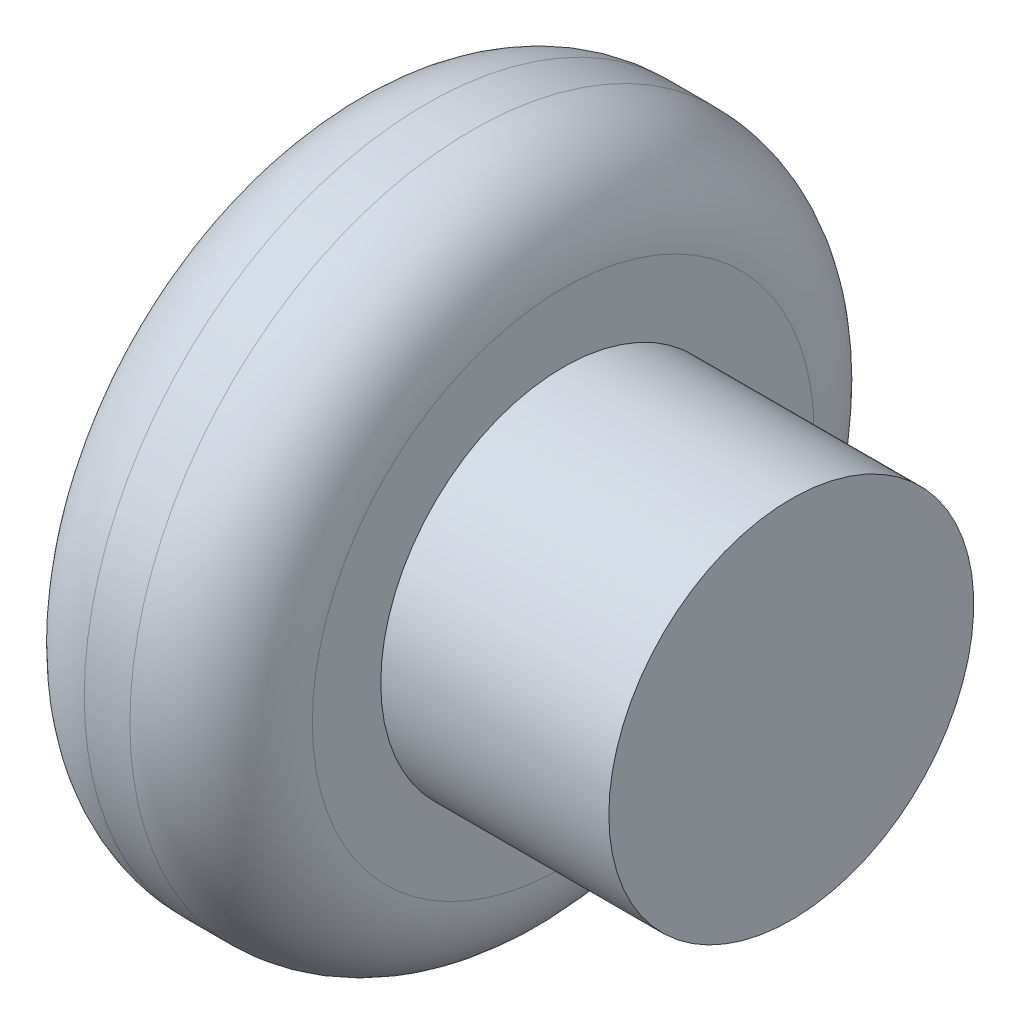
SolidWorks part; units mm, degrees
ref_plane "前基準面" through (0, 0, 0) normal (0, 0, 1) x (1, 0, 0)
ref_plane "上基準面" through (0, 0, 0) normal (0, 1, 0) x (1, 0, 0)
ref_plane "右基準面" through (0, 0, 0) normal (1, 0, 0) x (0, 0, -1)
sketch "草圖1" plane through (0, 0, 0) normal (0, 0, 1) x (1, 0, 0)
  line L1 (0, 0) -> (20, 0)
  line L2 (0, 0) -> (0, 11)
  line L3 (4, 15) -> (6, 15)
  line L4 (10, 8) -> (10, 11)
  line L7 (10, 8) -> (20, 8)
  line L8 (20, 0) -> (20, 8)
  arc A0 (6, 15) -> (10, 11) centre (6, 11) cw
  arc A1 (0, 11) -> (4, 15) centre (4, 11) cw
  point P9 (10, 15)
  point P12 (0, 15)
  dimension "D5" = 4
  dimension "D1" = 15
  dimension "D2" = 8
  dimension "D3" = 10
  dimension "D4" = 20
revolve "旋轉1" add sketch "草圖1" angle 360 about L1
